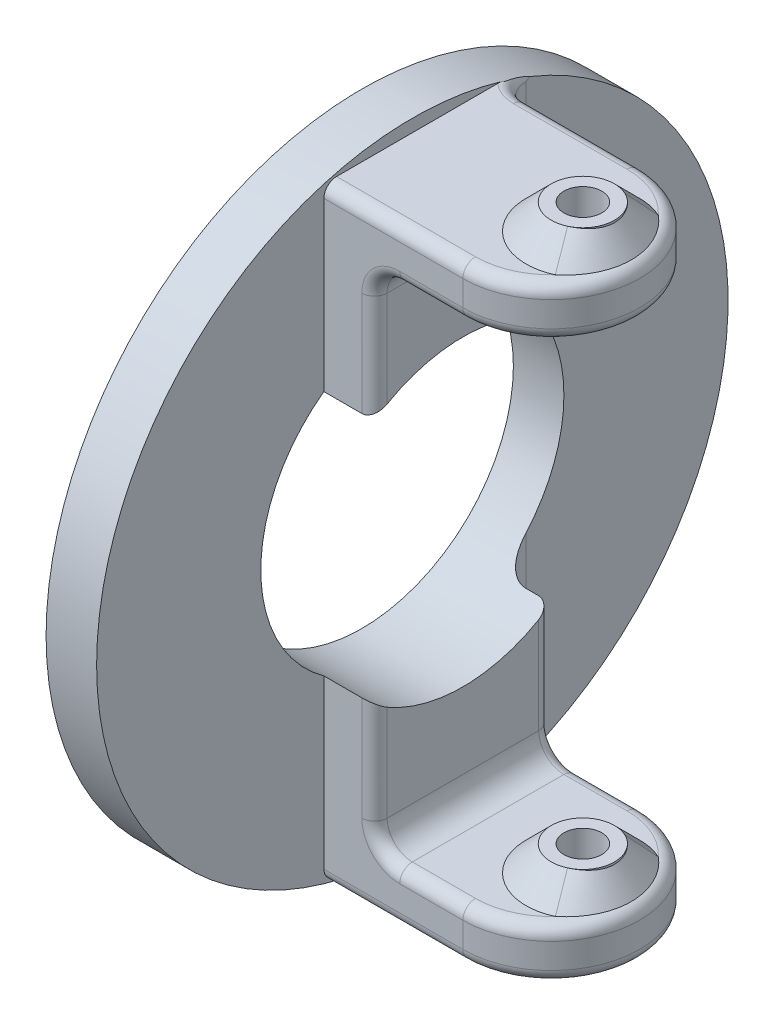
SolidWorks part; units mm, degrees
ref_plane "Front Plane" through (0, 0, 0) normal (0, 0, 1) x (1, 0, 0)
ref_plane "Top Plane" through (0, 0, 0) normal (0, 1, 0) x (1, 0, 0)
ref_plane "Right Plane" through (0, 0, 0) normal (1, 0, 0) x (0, 0, -1)
sketch "Sketch1" plane through (0, 0, 0) normal (0, 1, 0) x (1, 0, 0)
  line L0 (0, -22.225) -> (-22.225, -22.225)
  line L1 (-22.225, -22.225) -> (-22.225, 22.225)
  line L2 (-22.225, 22.225) -> (0, 22.225)
  circle A0 centre (0, 0) radius 9.525
  arc A1 (0, -22.225) -> (0, 22.225) centre (0, 0) ccw
  circle A2 centre (0, 0) radius 22.225 construction
extrude "Extrude1" add sketch "Sketch1" along normal blind 12.7
sketch "Sketch2" plane through (-22.225, 0, 0) normal (-1, 0, 0) x (0, 0, 1)
  line L1 (-22.225, 0) -> (22.225, 0)
  line L2 (-22.225, 0) -> (-22.225, 152.4)
  line L3 (-22.225, 152.4) -> (22.225, 152.4)
  line L4 (22.225, 0) -> (22.225, 152.4)
extrude "Extrude2" add sketch "Sketch2" along normal blind 12.7
sketch "Sketch3" plane through (0, 152.4, 0) normal (0, 1, 0) x (1, 0, 0)
  line L0 (-22.225, 22.225) -> (0, 22.225)
  line L1 (-22.225, -22.225) -> (0, -22.225)
  line L2 (-22.225, 22.225) -> (-22.225, -22.225)
  circle A0 centre (0, 0) radius 9.525
  arc A1 (0, 22.225) -> (0, -22.225) centre (0, 0) cw
extrude "Extrude4" add sketch "Sketch3" against normal blind 12.7 contours L1 A1 L0 A0 M1
sketch "Sketch4" plane through (-34.925, 0, 0) normal (-1, 0, 0) x (0, 0, 1)
  line L0 (-22.225, 152.4) -> (-22.225, 0) construction
  line L1 (22.225, 152.4) -> (-22.225, 152.4) construction
  circle A0 centre (0, 76.2) radius 19.05
  dimension "D1" = 22.225
  dimension "D2" = 76.2
  dimension "D3" = 38.1
extrude "Cut-Extrude1" cut sketch "Sketch4" against normal blind 12.7
sketch "Sketch5" plane through (-34.925, 0, 0) normal (-1, 0, 0) x (0, 0, 1)
  circle A0 centre (0, 76.2) radius 79.375
  circle A1 centre (0, 76.2) radius 19.05
extrude "Extrude5" add sketch "Sketch5" along normal blind 12.7
sketch "Sketch6" plane through (-22.225, 0, 0) normal (1, 0, 0) x (0, 0, -1)
  circle A0 centre (0, 76.2) radius 38.1
extrude "Cut-Extrude2" cut sketch "Sketch6" against normal blind 25.4
fillet "Fillet2" radius 6.35 4 edges at (-22.225, 139.7, 0) (-34.925, 22.627, -22.225) (-34.925, 129.773, -22.225)
sketch "Sketch9" plane through (0, 0, 0) normal (0, -1, 0) x (1, 0, 0)
  circle A0 centre (0, 0) radius 9.525
extrude "Extrude8" add sketch "Sketch9" against normal up to surface (12.7 mm away)
sketch "Sketch10" plane through (0, 152.4, 0) normal (0, 1, 0) x (1, 0, 0)
  circle A0 centre (0, 0) radius 9.525
extrude "Extrude9" add sketch "Sketch10" against normal up to surface (12.7 mm away)
sketch "Sketch11" plane through (0, 0, 0) normal (0, -1, 0) x (1, 0, 0)
  circle A1 centre (7.9375, 0) radius 4.7625
extrude "Cut-Extrude3" cut sketch "Sketch11" against normal up to surface (152.4 mm away)
fillet "Fillet3" radius 3.175 24 edges at (-17.4625, 152.4, 22.225) (22.225, 152.4, 0) (22.225, 139.7, 0) (22.225, 12.7, 0) (-17.4625, 0, 22.225) (-14.2875, 0, -22.225) (22.225, 0, 0) (-14.2875, 152.4, -22.225) (-7.9375, 139.7, -22.225) (-7.9375, 139.7, 22.225) (-32.4135, 152.0114, -23.5165) (-33.3896, 0.6796, -24.4347) (-20.3651, 14.5599, 22.225) (-20.3651, 14.5599, -22.225) (-20.3651, 137.8401, -22.225) (-20.3651, 137.8401, 22.225) (-31.75, 152.4, -22.225) (-31.75, 0, -22.225)
sketch "Sketch12" plane through (0, 12.7, 0) normal (0, 1, 0) x (1, 0, 0)
  circle A0 centre (7.9375, 0) radius 4.7625
  circle A1 centre (7.9375, 0) radius 7.9375
extrude "Extrude10" add sketch "Sketch12" along normal blind 6.35
sketch "Sketch13" plane through (0, 152.4, 0) normal (0, 1, 0) x (1, 0, 0)
  circle A0 centre (7.9375, 0) radius 4.7625
  circle A1 centre (7.9375, 0) radius 7.9375
extrude "Extrude11" add sketch "Sketch13" along normal blind 6.35
chamfer "Chamfer2" distance 6.35 angle 45 2 edges at (7.9375, 152.4, -7.9375) (7.9375, 12.7, 7.9375)
